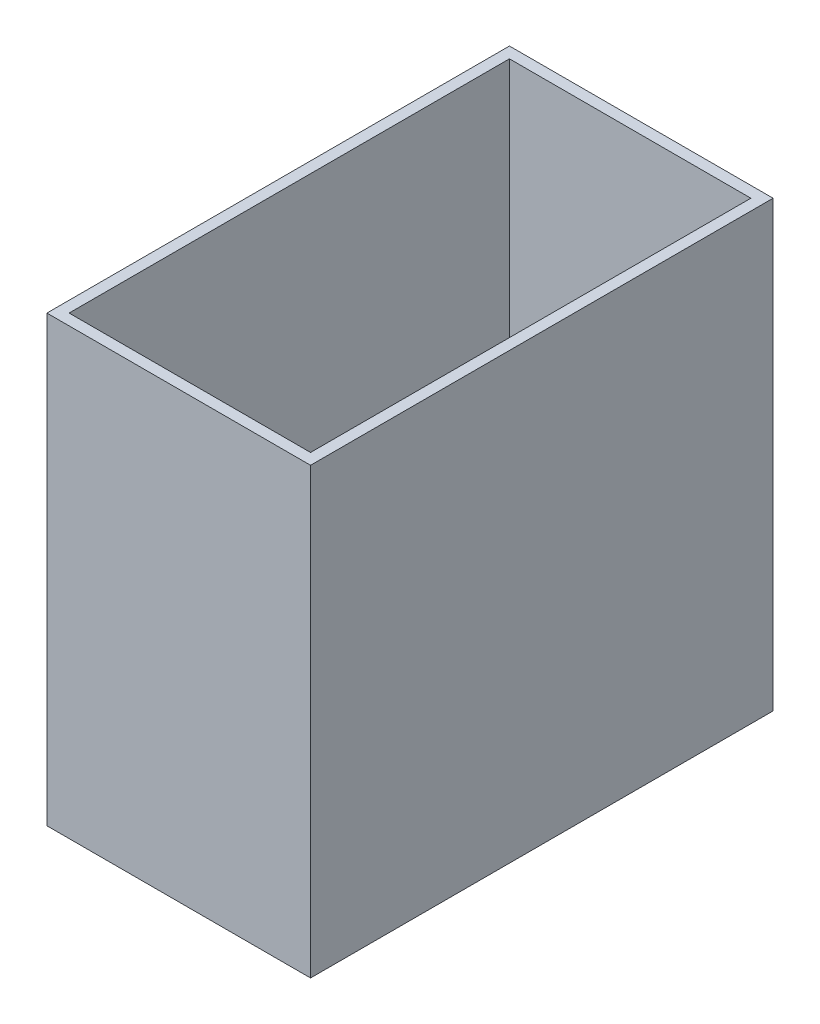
SolidWorks part; units mm, degrees
ref_plane "Plano frontal" through (0, 0, 0) normal (0, 0, 1) x (1, 0, 0)
ref_plane "Plano superior" through (0, 0, 0) normal (0, 1, 0) x (1, 0, 0)
ref_plane "Plano direito" through (0, 0, 0) normal (1, 0, 0) x (0, 0, -1)
sketch "Esboço1" plane through (0, 0, 0) normal (0, 1, 0) x (1, 0, 0)
  line L1 (0, 0) -> (142.5, 0)
  line L2 (0, 0) -> (0, -250)
  line L3 (0, -250) -> (142.5, -250)
  line L4 (142.5, 0) -> (142.5, -250)
extrude "Ressalto-extrusão1" add sketch "Esboço1" along normal blind 240
sketch "Esboço2" plane through (0, 240, 0) normal (0, 1, 0) x (1, 0, 0)
  line L0 (-142.5, -125) -> (142.5, -125)
  line L2 (142.5, -250) -> (142.5, 0) construction
  line L3 (71.25, -500) -> (71.25, 0)
  line L5 (142.5, 0) -> (0, 0) construction
  line L6 (0, 0) -> (0, -250) construction
  line L7 (6, -6) -> (136.5, -6)
  line L8 (6, -6) -> (6, -244)
  line L9 (6, -244) -> (136.5, -244)
  line L10 (136.5, -6) -> (136.5, -244)
  line L11 (6, -6) -> (136.5, -244) construction
  line L12 (6, -244) -> (136.5, -6) construction
  line L13 (0, -250) -> (142.5, -250) construction
  point P0 (71.25, -125)
  point P3 (0, -125)
  point P8 (71.25, -250)
  dimension "D1" = 6
  dimension "D2" = 6
  dimension "D3" = 6
extrude "Corte-extrusão1" cut sketch "Esboço2" against normal blind 234 contours L8 L7 L10 L9
